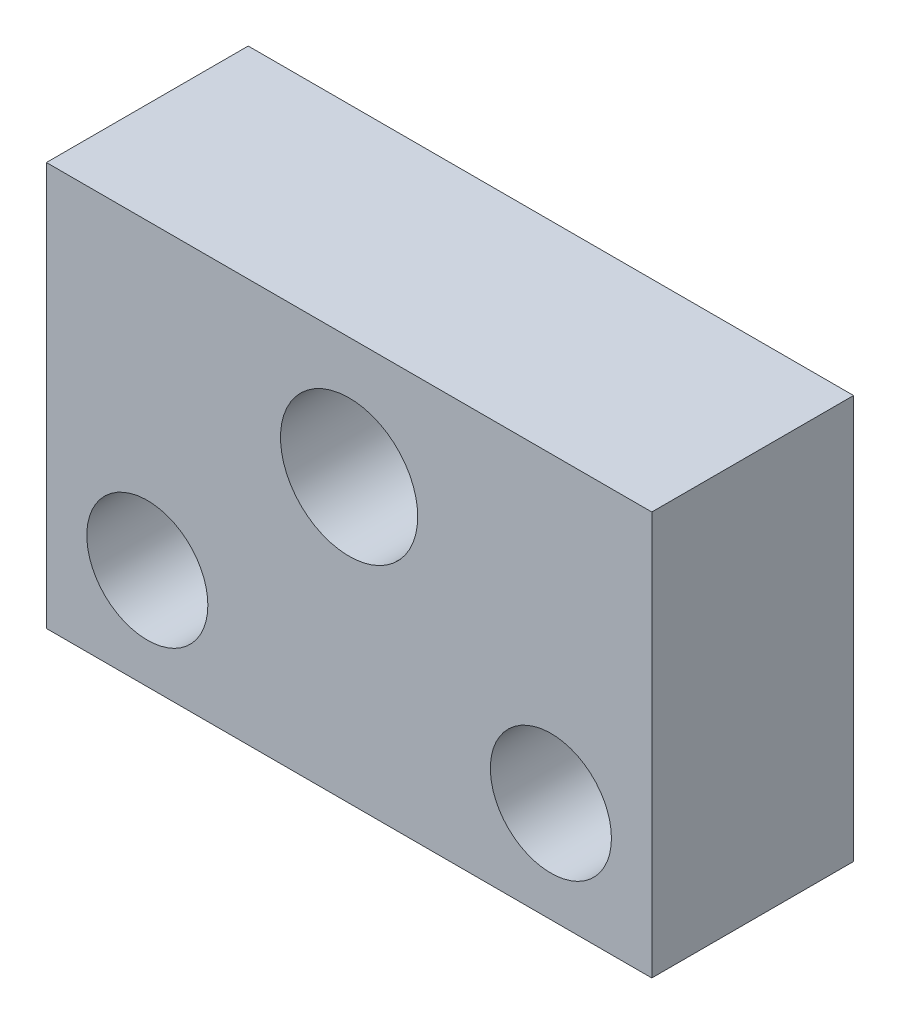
SolidWorks part; units mm, degrees
ref_plane "Plan de face" through (0, 0, 0) normal (0, 0, 1) x (1, 0, 0)
ref_plane "Plan de dessus" through (0, 0, 0) normal (0, 1, 0) x (1, 0, 0)
ref_plane "Plan de droite" through (0, 0, 0) normal (1, 0, 0) x (0, 0, -1)
sketch "Esquisse1" plane through (0, 0, 0) normal (0, 0, 1) x (1, 0, 0)
  line L1 (15, 10) -> (-15, 10)
  line L2 (15, 10) -> (15, -10)
  line L3 (15, -10) -> (-15, -10)
  line L4 (-15, 10) -> (-15, -10)
  line L5 (15, 10) -> (-15, -10) construction
  line L6 (15, -10) -> (-15, 10) construction
  circle A0 centre (-10, -5) radius 3
  circle A1 centre (10, -5) radius 3
  point P0 (0, 0)
  dimension "D3" = 6
  dimension "D4" = 6
  dimension "D6" = 5
  dimension "D8" = 5
  dimension "D1" = 30
  dimension "D2" = 20
  dimension "D5" = 20
  dimension "D7" = 5
extrude "Boss.-Extru.1" add sketch "Esquisse1" along normal blind 10
hole_wizard "Trou taraudé M8x1.251" positions "Esquisse3" profile "Esquisse2" tap size "M8x1.25" standard "Ansi Metric"
sketch "Esquisse3" plane through (0, 0, 10) normal (0, 0, 1) x (1, 0, 0)
  line L0 (-15, -10) -> (15, -10) construction
  line L1 (15, -10) -> (15, 10) construction
  point P0 (0, 4)
  dimension "D1" = 14
  dimension "D2" = 15
sketch "Esquisse2" plane through (0, 4, 10) normal (1, 0, 0) x (0, -1, 0)
  line L0 (0, 0) -> (0, 10)
  line L1 (0, 10) -> (3.4, 10)
  line L2 (3.4, 10) -> (3.4, 0)
  line L5 (3.4, 0) -> (0, 0)
  line L11 (0, -6.35) -> (0, 107.95) construction
  dimension "Diamètre du trou pour taraudage jusqu'au prochain" = 6.8
  dimension "Profondeur du trou pour taraudage jusqu'au prochain" = 10
sketch "Esquisse4" [suppressed] plane through (0, 0, 10) normal (0, 0, 1) x (1, 0, 0)
  line L1 (0, 4) -> (15.5814, 4)
  line L2 (0, 4) -> (0, 10.8034)
  line L3 (0, 10.8034) -> (15.5814, 10.8034)
  line L4 (15.5814, 4) -> (15.5814, 10.8034)
extrude "Enlèv. mat.-Extru.1" [suppressed] cut sketch "Esquisse4" against normal blind 10
